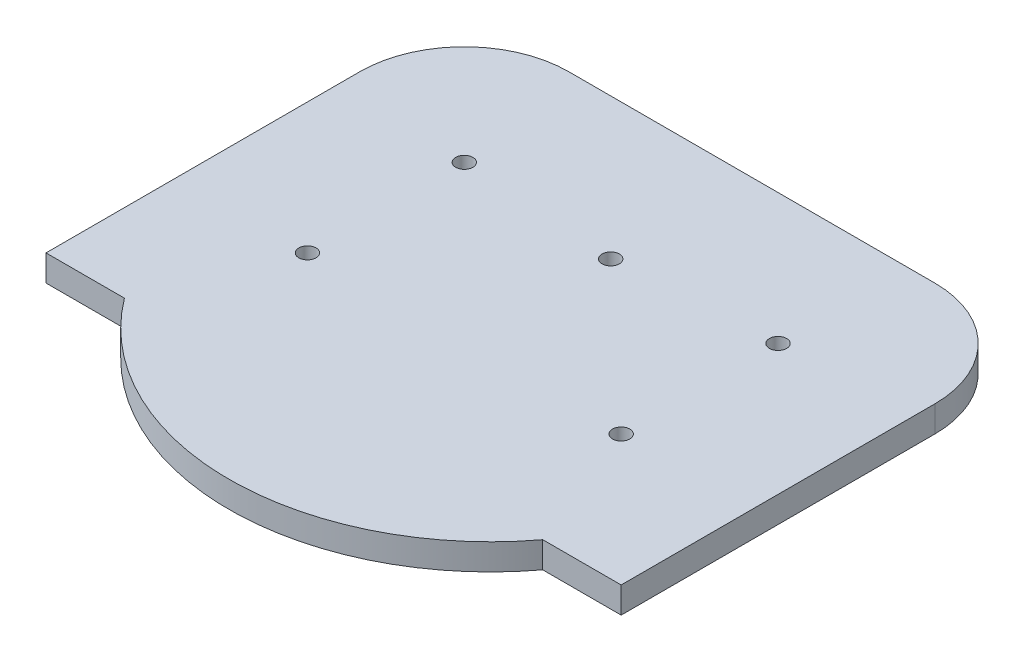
SolidWorks part; units mm, degrees
ref_plane "Front Plane" through (0, 0, 0) normal (0, 0, 1) x (1, 0, 0)
ref_plane "Top Plane" through (0, 0, 0) normal (0, 1, 0) x (1, 0, 0)
ref_plane "Right Plane" through (0, 0, 0) normal (1, 0, 0) x (0, 0, -1)
sketch "Sketch1" plane through (0, 0, 0) normal (0, 1, 0) x (1, 0, 0)
  line L0 (55, 80) -> (55, 14.9024) construction
  line L1 (0, 0) -> (15, 0)
  line L2 (0, 0) -> (0, 60)
  line L3 (20, 80) -> (90, 80)
  line L4 (110, 0) -> (110, 60)
  line L5 (95, 0) -> (110, 0)
  arc A0 (15, 0) -> (95, 0) centre (55, 30) ccw
  arc A1 (0, 60) -> (20, 80) centre (20, 60) cw
  arc A2 (110, 60) -> (90, 80) centre (90, 60) ccw
  point P12 (0, 80)
  point P15 (110, 80)
  dimension "D3" = 50
  dimension "D4" = 50
  dimension "D5" = 20
  dimension "D1" = 110
  dimension "D2" = 80
extrude "Extrude1" add sketch "Sketch1" along normal blind 5
sketch "Sketch2" plane through (0, 5, 0) normal (0, 1, 0) x (1, 0, 0)
  line L0 (90, 80) -> (20, 80) construction
  line L1 (55, 80) -> (55, 5.4437) construction
  point P0 (25, 55)
  point P1 (55, 53)
  point P2 (85, 55)
  point P3 (85, 25)
  point P4 (25, 25)
  dimension "D1" = 25
  dimension "D2" = 27
  dimension "D3" = 25
  dimension "D4" = 30
  dimension "D5" = 30
  dimension "D6" = 30
  dimension "D7" = 30
  dimension "D8" = 60
  dimension "D9" = 30
hole_wizard "M4 Tapped Hole1" positions "3DSketch2" profile "Sketch5" tap size "M4" standard "ISO"
sketch3d "3DSketch2"
  point P0 (25, 5, -55)
  point P3 (55, 5, -53)
  point P6 (85, 5, -55)
  point P9 (85, 5, -25)
  point P12 (25, 5, -25)
sketch "Sketch5" plane through (25, 5, -55) normal (1, 0, 0) x (0, 0, 1)
  line L0 (0, 0) -> (0, 5)
  line L1 (0, 5) -> (1.65, 5)
  line L2 (1.65, 5) -> (1.65, 0)
  line L5 (1.65, 0) -> (0, 0)
  line L11 (0, -6.35) -> (0, 107.95) construction
  dimension "Thru Tap Drill Dia." = 3.3
  dimension "Thru Tap Drill Depth" = 5
